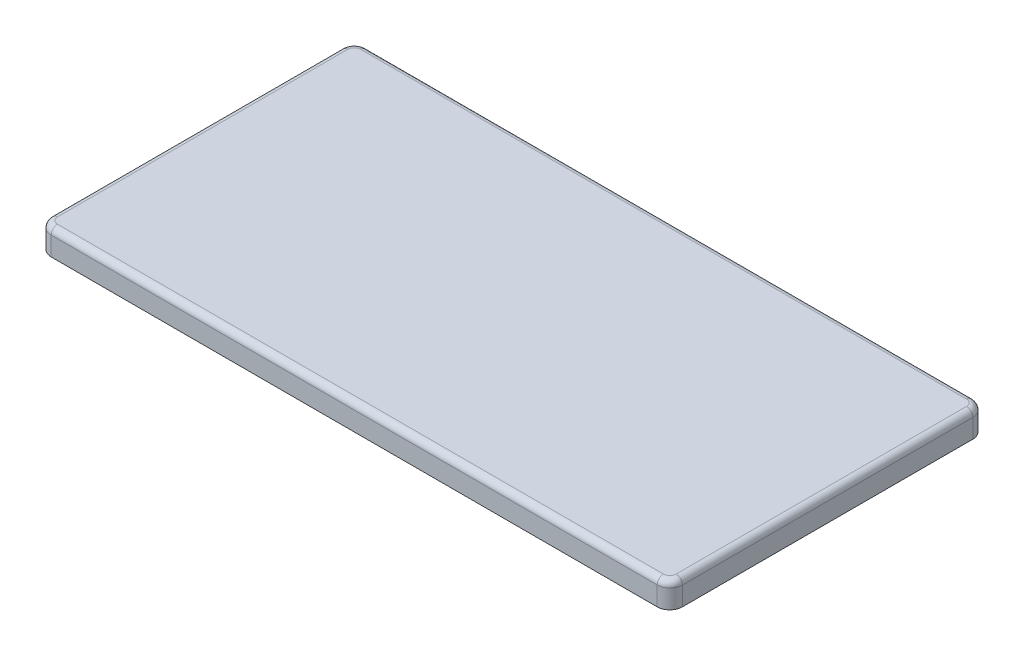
SolidWorks part; units mm, degrees
ref_plane "正面" through (0, 0, 0) normal (0, 0, 1) x (1, 0, 0)
ref_plane "平面" through (0, 0, 0) normal (0, 1, 0) x (1, 0, 0)
ref_plane "右側面" through (0, 0, 0) normal (1, 0, 0) x (0, 0, -1)
sketch "ｽｹｯﾁ1" plane through (0, 0, 0) normal (0, 1, 0) x (0, 0, -1)
  line L1 (-23, 50) -> (23, 50)
  line L2 (-25, 48) -> (-25, -48)
  line L3 (-23, -50) -> (23, -50)
  line L4 (25, 48) -> (25, -48)
  arc A0 (25, 48) -> (23, 50) centre (23, 48) ccw
  arc A1 (23, -50) -> (25, -48) centre (23, -48) ccw
  arc A2 (-25, -48) -> (-23, -50) centre (-23, -48) ccw
  arc A3 (-23, 50) -> (-25, 48) centre (-23, 48) ccw
  point P7 (25, 50)
  point P10 (25, -50)
  point P15 (-25, 50)
  dimension "D5" = 2
  dimension "D1" = 25
  dimension "D2" = 50
  dimension "D3" = 50
  dimension "D4" = 100
extrude "押し出し1" add sketch "ｽｹｯﾁ1" along normal mid plane 4
fillet "ﾌｨﾚｯﾄ1" radius 1 8 edges at (-49.4142, 2, 24.4142) (-50, 2, 0) (-49.4142, 2, -24.4142) (0, 2, -25) (49.4142, 2, -24.4142) (50, 2, 0) (49.4142, 2, 24.4142) (0, 2, 25)
sketch "ｽｹｯﾁ2" plane through (0, -2, 0) normal (0, -1, 0) x (1, 0, 0)
  line L1 (-47.2, 23) -> (47.2, 23)
  line L2 (-48, 22.2) -> (-48, -22.2)
  line L3 (-47.2, -23) -> (47.2, -23)
  line L4 (48, 22.2) -> (48, -22.2)
  arc A0 (-47.2, 23) -> (-48, 22.2) centre (-47.2, 22.2) ccw
  arc A1 (48, 22.2) -> (47.2, 23) centre (47.2, 22.2) ccw
  arc A2 (47.2, -23) -> (48, -22.2) centre (47.2, -22.2) ccw
  arc A3 (-48, -22.2) -> (-47.2, -23) centre (-47.2, -22.2) ccw
  point P7 (-48, 23)
  point P10 (48, 23)
  point P13 (48, -23)
  dimension "D5" = 0.8
  dimension "D1" = 48
  dimension "D2" = 96
  dimension "D3" = 23
  dimension "D4" = 46
extrude "押し出し2" cut sketch "ｽｹｯﾁ2" against normal blind 2
sketch "ｽｹｯﾁ4" plane through (0, 0, 0) normal (0, -1, 0) x (1, 0, 0)
  line L1 (-33.7477, 0.7071) -> (-30.7071, 3.7477)
  line L2 (-33.7477, 0.7071) -> (-29.2929, -3.7477)
  line L3 (-29.2929, -3.7477) -> (-26.2523, -0.7071)
  line L4 (-30.7071, 3.7477) -> (-26.2523, -0.7071)
  line L6 (26.2523, 0.7071) -> (29.2929, 3.7477)
  line L7 (26.2523, 0.7071) -> (30.7071, -3.7477)
  line L8 (30.7071, -3.7477) -> (33.7477, -0.7071)
  line L9 (29.2929, 3.7477) -> (33.7477, -0.7071)
  line L10 (-32.2274, 2.2274) -> (-27.7726, -2.2274) construction
  line L12 (-31.5203, -1.5203) -> (-28.4797, 1.5203) construction
  line L13 (32.2274, -2.2274) -> (27.7726, 2.2274) construction
  line L15 (31.5203, 1.5203) -> (28.4797, -1.5203) construction
  dimension "D1" = 4.3
  dimension "D2" = 6.3
  dimension "D5" = 4.3
extrude "押し出し4" add sketch "ｽｹｯﾁ4" along normal blind 11 draft 0.5
fillet "ﾌｨﾚｯﾄ2" radius 0.8 8 edges at (-32.1595, -11, 2.1595) (-28.5476, -11, 1.4524) (-27.8405, -11, -2.1595) (-31.4524, -11, -1.4524) (27.8405, -11, 2.1595) (31.4524, -11, 1.4524) (32.1595, -11, -2.1595) (28.5476, -11, -1.4524)
